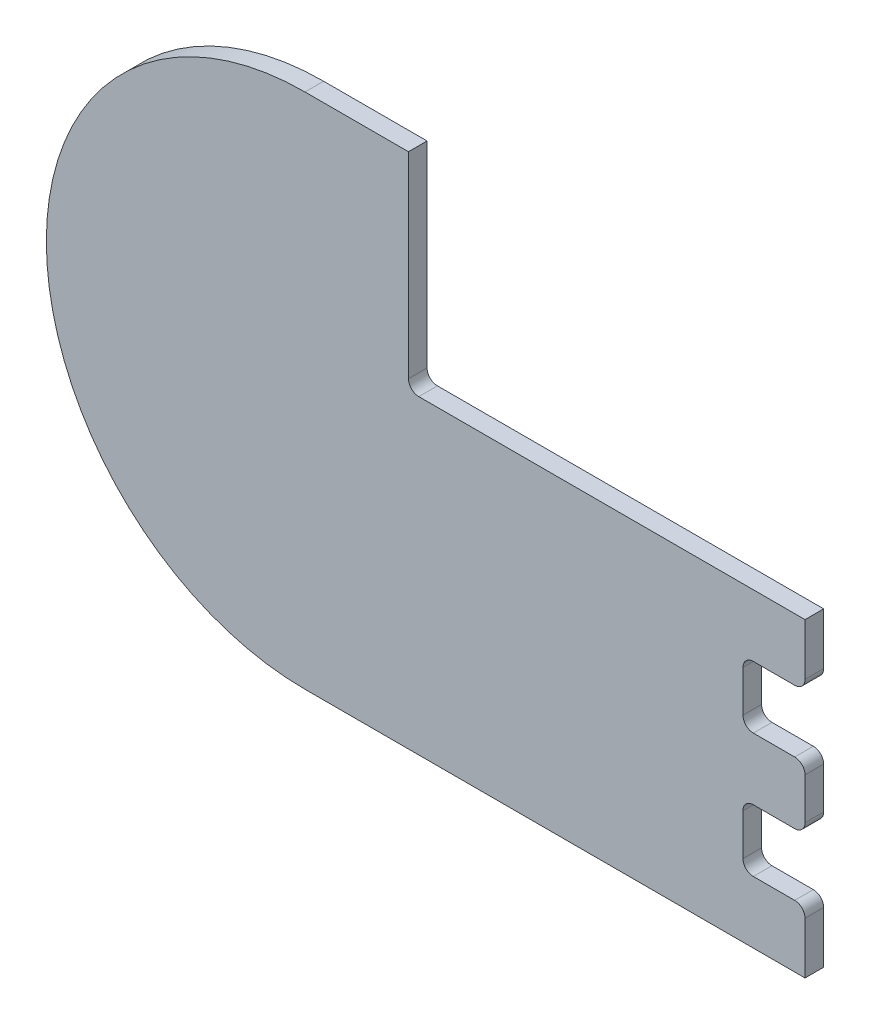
SolidWorks part; units mm, degrees
ref_plane "Plan de face" through (0, 0, 0) normal (0, 0, 1) x (1, 0, 0)
ref_plane "Plan de dessus" through (0, 0, 0) normal (0, 1, 0) x (1, 0, 0)
ref_plane "Plan de droite" through (0, 0, 0) normal (1, 0, 0) x (0, 0, -1)
sketch "Esquisse1" plane through (0, 0, 0) normal (0, 0, 1) x (1, 0, 0)
  line L1 (-850, -250) -> (850, -250)
  line L3 (-850, 250) -> (850, 250)
  arc A0 (-850, 250) -> (-850, -250) centre (-850, 0) ccw
  arc A1 (850, -250) -> (850, 250) centre (850, 0) ccw
  point P0 (0, 0)
  dimension "D3" = 500
  dimension "D5" = 500
extrude "Boss.-Extru.1" add sketch "Esquisse1" along normal blind 18
sketch "Esquisse2" plane through (0, 0, 18) normal (0, 0, 1) x (1, 0, 0)
  line L0 (850, 250) -> (750, 250) construction
  line L1 (850, 250) -> (-850, 250) construction
  line L2 (-850, 250) -> (-750, 250) construction
  line L3 (-750, 250) -> (-750, 50)
  line L4 (-750, 50) -> (750, 50)
  line L5 (750, 50) -> (750, 250)
  dimension "D1" = 100
  dimension "D2" = 100
  dimension "D3" = 200
extrude "Enlèv. mat.-Extru.1" cut sketch "Esquisse2" against normal blind 18 and the other way through all
sketch "Esquisse4" plane through (0, 0, 0) normal (0, 0, -1) x (-1, 0, 0)
  line L0 (-366.6667, -250) -> (-366.6667, 272.5751) construction
  line L1 (850, -250) -> (-850, -250) construction
  line L2 (366.6633, -250) -> (366.6633, 272.5751) construction
  dimension "D2" = 733.33
sketch "Esquisse5" plane through (0, 0, 0) normal (0, 0, -1) x (-1, 0, 0)
  line L0 (-366.6667, 50) -> (-366.6667, -10)
  line L1 (-366.6667, -250) -> (-366.6667, 272.5751) construction
  line L2 (750, 50) -> (-750, 50) construction
  line L3 (-366.6667, -10) -> (-426.6667, -10)
  line L4 (-426.6667, -10) -> (-426.6667, -70)
  line L5 (-426.6667, -70) -> (-366.6667, -70)
  line L6 (-366.6667, -70) -> (-366.6667, -130)
  line L7 (-366.6667, -130) -> (-426.6667, -130)
  line L8 (-426.6667, -130) -> (-426.6667, -190)
  line L9 (-426.6667, -190) -> (-366.6667, -190)
  line L10 (-366.6667, -190) -> (-366.6667, -250)
  line L12 (0, 50) -> (0, -445.9359) construction
  line L13 (366.6667, -190) -> (366.6667, -250)
  line L14 (426.6667, -190) -> (366.6667, -190)
  line L15 (426.6667, -130) -> (426.6667, -190)
  line L16 (366.6667, -130) -> (426.6667, -130)
  line L17 (366.6667, -70) -> (366.6667, -130)
  line L18 (426.6667, -70) -> (366.6667, -70)
  line L19 (426.6667, -10) -> (426.6667, -70)
  line L20 (366.6667, -10) -> (426.6667, -10)
  line L21 (366.6667, 50) -> (366.6667, -10)
  line L22 (-366.6667, 50) -> (-750, 50)
  line L23 (-750, 50) -> (-750, 250)
  line L24 (-750, 250) -> (-850, 250)
  line L25 (-850, -250) -> (-366.6667, -250)
  line L26 (-366.6667, 50) -> (366.6667, 50)
  line L27 (-366.6667, -250) -> (366.6667, -250)
  line L28 (-366.6667, 50) -> (366.6667, 50)
  line L29 (-366.6667, -250) -> (366.6667, -250)
  arc A1 (-850, 250) -> (-850, -250) centre (-850, 0) ccw
  dimension "D1" = 60
extrude "Enlèv. mat.-Extru.2" cut sketch "Esquisse5" against normal blind 30 contours L12 L29 L13 L14 L15 L16 L17 L18 L19 L20 L21 M11 | L12 L28 L0 L3 L4 L5 L6 L7 L8 L9 L10 M15 | L10 L9 L8 L7 L6 L5 L4 L3 L0 M11 M12 M13 M14 M15
fillet "Congé4" radius 10 8 edges at (-366.6667, -10, 9) (-366.6667, -70, 9) (-366.6667, -130, 9) (-366.6667, -190, 9) (-426.6667, -190, 9) (-426.6667, -70, 9) (-426.6667, -130, 9) (-426.6667, -10, 9)
fillet "Congé5" radius 10 1 edges at (-750, 50, 9)
sketch "Esquisse6" plane through (0, 0, 0) normal (0, 0, -1) x (-1, 0, 0)
  line L0 (396.6667, -10) -> (396.6667, 50) construction
  line L1 (376.6667, -10) -> (416.6667, -10) construction
  line L2 (740, 50) -> (366.6667, 50) construction
  line L3 (389.788, 34) -> (389.788, 31.8787) construction
  line L4 (391.9093, 6) -> (401.424, 6)
  line L5 (387.6667, 10.2426) -> (387.6667, 29.7574)
  line L6 (391.9093, 34) -> (401.424, 34)
  line L7 (405.6667, 10.2426) -> (405.6667, 29.7574)
  line L8 (387.6667, 6) -> (405.6667, 34) construction
  line L9 (387.6667, 34) -> (405.6667, 6) construction
  line L10 (389.788, 31.8787) -> (387.6667, 31.8787) construction
  arc A0 (391.9093, 34) -> (387.6667, 29.7574) centre (389.788, 31.8787) ccw
  arc A1 (401.424, 6) -> (405.6667, 10.2426) centre (403.5453, 8.1213) ccw
  arc A2 (391.9093, 6) -> (387.6667, 10.2426) centre (389.788, 8.1213) cw
  arc A3 (401.424, 34) -> (405.6667, 29.7574) centre (403.5453, 31.8787) cw
  point P6 (396.6667, 20)
  point P21 (396.6667, 20)
  dimension "D3" = 6
  dimension "D1" = 18
  dimension "D2" = 28
  dimension "D4" = 2
extrude "Enlèv. mat.-Extru.3" cut sketch "Esquisse6" against normal blind 9
pattern_linear "Répétition linéaire1" count 3 spacing 120 along (0, -1, 0) of "Enlèv. mat.-Extru.3"
sketch "Esquisse7" plane through (0, 0, 0) normal (0, 0, -1) x (-1, 0, 0)
  line L0 (850, -250) -> (366.6667, -250) construction
  line L1 (463.187, -250) -> (1122.9459, -250)
  line L2 (463.187, -250) -> (463.187, 300.8484)
  line L3 (463.187, 300.8484) -> (1122.9459, 300.8484)
  line L4 (1122.9459, -250) -> (1122.9459, 300.8484)
